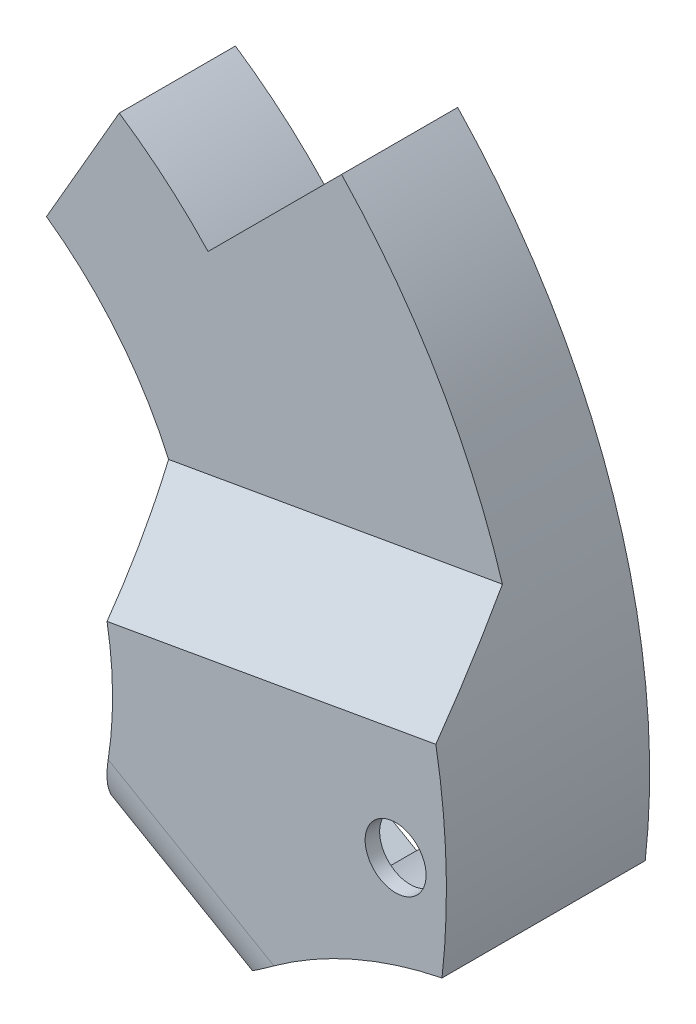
SolidWorks part; units mm, degrees
ref_plane "前视基准面" through (0, 0, 0) normal (0, 0, 1) x (1, 0, 0)
ref_plane "上视基准面" through (0, 0, 0) normal (0, 1, 0) x (1, 0, 0)
ref_plane "右视基准面" through (0, 0, 0) normal (1, 0, 0) x (0, 0, -1)
sketch "草图2" plane through (0, 0, 0) normal (0, 0, 1) x (1, 0, 0)
  line L0 (0, 0) -> (0, 48)
  line L1 (0, 0) -> (41.5692, -24)
  line L2 (4, 2.3094) -> (43.5692, -20.5359)
  line L3 (4, 2.3094) -> (4, 48)
  line L4 (4, 2.3094) -> (11.7969, 46.5278)
  line L5 (4, 2.3094) -> (47.6958, -5.3953) construction
  line L6 (4, 2.3094) -> (25.9722, 40.3664)
  line L7 (4, 2.3094) -> (34.7759, 33.0853)
  circle A0 centre (0, 0) radius 48
  circle A1 centre (0, 0) radius 25
  circle A2 centre (0, 0) radius 35
  arc A3 (32.1123, -13.9212) -> (47.6958, -5.3953) centre (53.6577, -34.797) cw
  dimension "D1" = 96
  dimension "D2" = 50
  dimension "D6" = 70
  dimension "D9" = 30
  dimension "D3" = 120
  dimension "D5" = 10
  dimension "D7" = 20
  dimension "D8" = 20
  dimension "D10" = 15
  dimension "D4" = 4
extrude "凸台-拉伸3" add sketch "草图2" along normal blind 8 contours L5 A2 A3 | A2 L5 A0 L6 | A1 L5 A2 L6 | L5 A1 L2 A3 A2 | L7 A2 L6 A1
sketch "草图3" plane through (0, 0, 8) normal (0, 0, 1) x (1, 0, 0)
  line L0 (24.6202, 4.3412) -> (47.2708, 8.3351)
  line L2 (34.7759, 33.0853) -> (25.5796, 23.889)
  line L3 (23.3717, -8.8749) -> (32.1123, -13.9212)
  line L5 (23.3717, -8.8749) -> (32.1123, -13.9212)
  line L7 (34.7759, 33.0853) -> (25.5796, 23.889)
  line L9 (19.4619, 29.0901) -> (14.4466, 20.4034)
  line L10 (19.4619, 29.0901) -> (14.4466, 20.4034)
  arc A3 (23.3717, -8.8749) -> (14.4466, 20.4034) centre (0, 0) ccw
  arc A4 (47.6958, -5.3953) -> (32.1123, -13.9212) centre (53.6577, -34.797) ccw
  arc A5 (47.6958, -5.3953) -> (34.7759, 33.0853) centre (0, 0) ccw
  arc A6 (23.3717, -8.8749) -> (14.4466, 20.4034) centre (0, 0) ccw
  arc A7 (47.6958, -5.3953) -> (32.1123, -13.9212) centre (53.6577, -34.797) ccw
  arc A8 (47.6958, -5.3953) -> (34.7759, 33.0853) centre (0, 0) ccw
  arc A10 (25.5796, 23.889) -> (19.4619, 29.0901) centre (0, 0) ccw
  arc A11 (25.5796, 23.889) -> (19.4619, 29.0901) centre (0, 0) ccw
  dimension "D2" = 40
  dimension "D1" = 0
extrude "凸台-拉伸4" add sketch "草图3" along normal blind 6 contours L0 M8 M9 M10 M11
chamfer "倒角1" distance 6 angle 45 1 edges at (35.9455, 6.3382, 8)
fillet "圆角1" radius 5 1 edges at (27.742, -11.398, 14)
sketch "草图5" plane through (0, 0, 14) normal (0, 0, 1) x (1, 0, 0)
  line L0 (4, 2.3094) -> (44.5, 0.1869) construction
  line L2 (4, 2.3094) -> (47.6958, -5.3953) construction
  dimension "D1" = 7
  dimension "D2" = 40.5
shell "抽壳1" thickness 1
hole_wizard "M5 螺纹孔1" positions "3D草图2" profile "草图6" tap size "M5" standard "GB"
sketch3d "3D草图2"
  point P0 (44.5, 0.1869, 14)
sketch "草图6" plane through (44.5, 0.1869, 14) normal (1, 0, 0) x (0, -1, 0)
  line L0 (0, 0) -> (0, 13.6618)
  line L1 (0, 13.6618) -> (2.1, 12.4)
  line L2 (2.1, 12.4) -> (2.1, 0)
  line L5 (2.1, 0) -> (0, 0)
  line L10 (0, 13.6618) -> (-2.1, 12.4) construction
  line L11 (0, -6.35) -> (0, 107.95) construction
  dimension "螺纹孔钻头直径" = 4.2
  dimension "螺纹孔钻头深度" = 12.4
  dimension "导头角度" = 118
sketch "草图7" plane through (0, 0, 7) normal (0, 0, -1) x (-1, 0, 0)
  line L0 (-34.3086, 23.5317) -> (-4, 2.3094) construction
  line L1 (-4, 2.3094) -> (-34.7759, 33.0853) construction
  circle A0 centre (-34.3086, 23.5317) radius 1.5
  dimension "D1" = 3
  dimension "D2" = 10
  dimension "D3" = 37
extrude "凸台-拉伸5" add sketch "草图7" along normal blind 7
sketch "草图8" plane through (2.866, -1.6547, 0) normal (0.866, -0.5, 0) x (0, 0, -1)
  line L4 (0, 25.7885) -> (0, 33.8386)
  line L5 (0, 33.8386) -> (-7, 33.8386)
  line L6 (-7, 33.8386) -> (-7, 25.7885)
  line L7 (-7, 25.7885) -> (0, 25.7885)
  line L8 (0, 25.7885) -> (0, 33.8386)
  line L9 (0, 33.8386) -> (-7, 33.8386)
  line L10 (-7, 33.8386) -> (-7, 25.7885)
  line L11 (-7, 25.7885) -> (0, 25.7885)
  dimension "D1" = 0
extrude "切除-拉伸1" cut sketch "草图8" against normal blind 10
